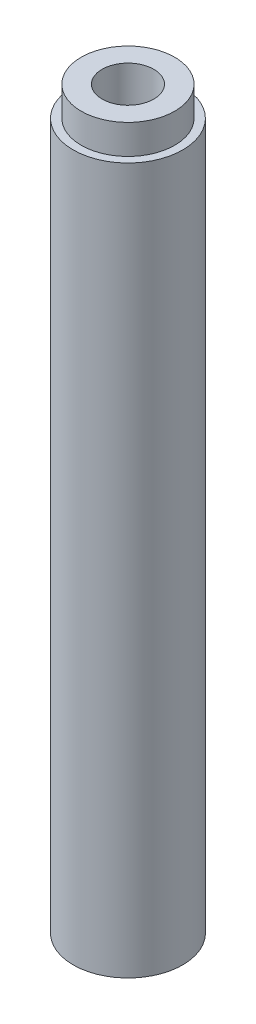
SolidWorks part; units mm, degrees
ref_plane "Front Plane" through (0, 0, 0) normal (0, 0, 1) x (1, 0, 0)
ref_plane "Top Plane" through (0, 0, 0) normal (0, 1, 0) x (1, 0, 0)
ref_plane "Right Plane" through (0, 0, 0) normal (1, 0, 0) x (0, 0, -1)
sketch "Sketch1" plane through (0, 0, 0) normal (0, 1, 0) x (1, 0, 0)
  circle A0 centre (0, 0) radius 5.6515
  dimension "D1" = 11.303
extrude "Boss-Extrude1" add sketch "Sketch1" against normal blind 75.8698
sketch "Sketch2" plane through (0, 0, 0) normal (0, 1, 0) x (1, 0, 0)
  circle A0 centre (0, 0) radius 4.826
  circle A1 centre (0, 0) radius 5.6515 construction
  circle A2 centre (0, 0) radius 5.6515
  dimension "D1" = 9.652
extrude "Cut-Extrude1" cut sketch "Sketch2" against normal blind 3.048
sketch "Sketch3" plane through (0, 0, 0) normal (0, 1, 0) x (1, 0, 0)
  circle A0 centre (0, 0) radius 2.667
  dimension "D1" = 5.334
extrude "Cut-Extrude2" cut sketch "Sketch3" against normal blind 24.257
sketch "Sketch4" plane through (0, -75.8698, 0) normal (0, -1, 0) x (1, 0, 0)
  circle A0 centre (0, 0) radius 2.667
  dimension "D1" = 5.334
extrude "Cut-Extrude3" cut sketch "Sketch4" against normal blind 24.257
